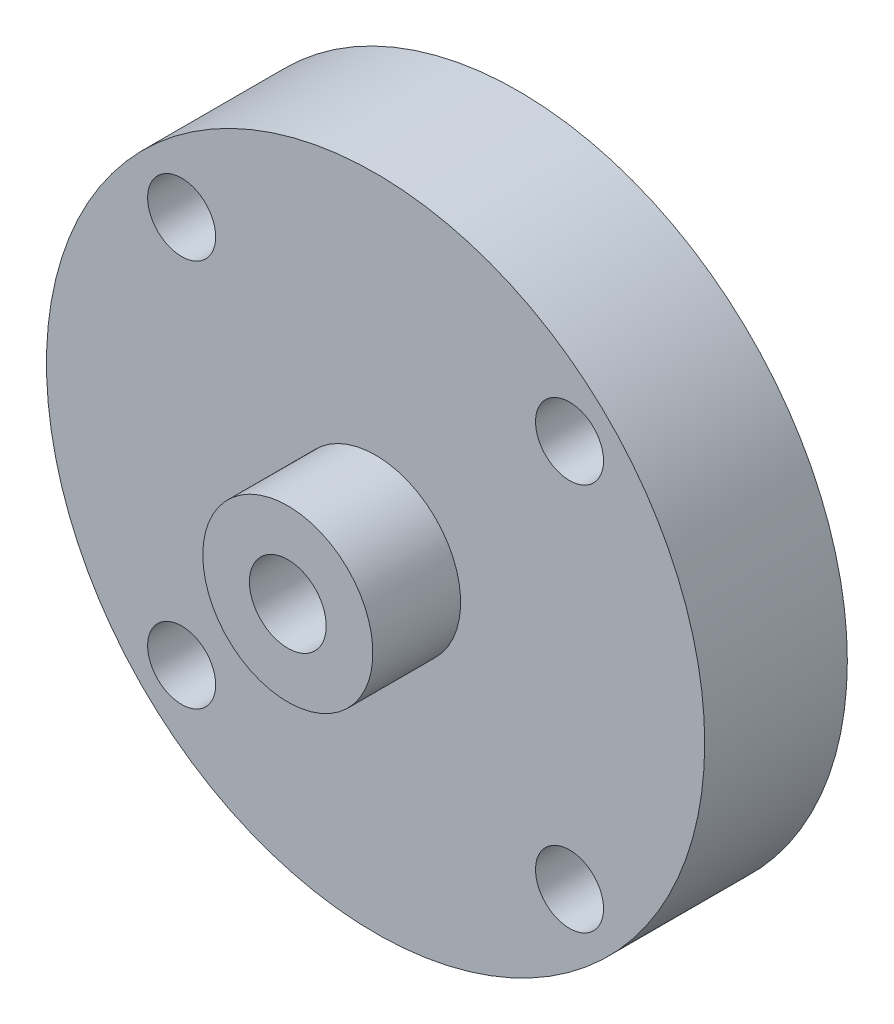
SolidWorks part; units mm, degrees
ref_plane "Alzado" through (0, 0, 0) normal (0, 0, 1) x (1, 0, 0)
ref_plane "Planta" through (0, 0, 0) normal (0, 1, 0) x (1, 0, 0)
ref_plane "Vista lateral" through (0, 0, 0) normal (1, 0, 0) x (0, 0, -1)
sketch "Croquis1" plane through (0, 0, 0) normal (0, 0, 1) x (1, 0, 0)
  circle A0 centre (0, 158.0446) radius 1.55
  circle A5 centre (8.8388, 149.2057) radius 1.55
  circle A6 centre (-8.8388, 149.2057) radius 1.55
  circle A7 centre (-8.8388, 166.8834) radius 1.55
  circle A8 centre (8.8388, 166.8834) radius 1.55
  circle A9 centre (0, 158.0446) radius 15
extrude "Saliente-Extruir1" add sketch "Croquis1" against normal blind 2
sketch "Croquis2" plane through (0, 0, 0) normal (0, 0, 1) x (1, 0, 0)
  circle A1 centre (-8.8388, 149.2057) radius 1.55 construction
  circle A2 centre (0, 158.0446) radius 17.5
  circle A3 centre (0, 158.0446) radius 17.5
  circle A4 centre (8.8388, 149.2057) radius 1.55 construction
  circle A5 centre (-8.8388, 166.8834) radius 1.55 construction
  circle A6 centre (8.8388, 166.8834) radius 1.55 construction
  circle A7 centre (-8.8388, 149.2057) radius 1.55
  circle A8 centre (8.8388, 149.2057) radius 1.55
  circle A9 centre (-8.8388, 166.8834) radius 1.55
  circle A10 centre (8.8388, 166.8834) radius 1.55
  circle A11 centre (0, 158.0446) radius 3.875
  circle A12 centre (0, 158.0446) radius 1.55
  dimension "D2" = 7.75
  dimension "D1" = 2.5
extrude "Saliente-Extruir2" add sketch "Croquis2" along normal blind 4.5 contours A11 M7 M4 M6 M5 M3
sketch "Croquis3" plane through (0, 0, 0) normal (0, 0, 1) x (1, 0, 0)
  circle A0 centre (0, 158.0446) radius 1.55 construction
  circle A1 centre (0, 158.0446) radius 3.875
  circle A2 centre (0, 158.0446) radius 3.875
  circle A3 centre (0, 158.0446) radius 1.55
  dimension "D1" = 0
extrude "Saliente-Extruir3" add sketch "Croquis3" along normal offset from surface (8.5 mm away) 4
sketch "Croquis4" plane through (0, 0, -2) normal (0, 0, -1) x (-1, 0, 0)
  line L0 (-2.1213, 155.9233) -> (2.1213, 160.1659) construction
  circle A0 centre (0, 158.0446) radius 2.875
  dimension "D1" = 5.75
extrude "Cortar-Extruir1" cut sketch "Croquis4" against normal blind 3.3
sketch "Croquis5" plane through (0, 0, 1.3) normal (0, 0, -1) x (-1, 0, 0)
  circle A0 centre (0, 158.0446) radius 1.75
  dimension "D1" = 3.5
extrude "Cortar-Extruir2" cut sketch "Croquis5" against normal through all and the other way through all
